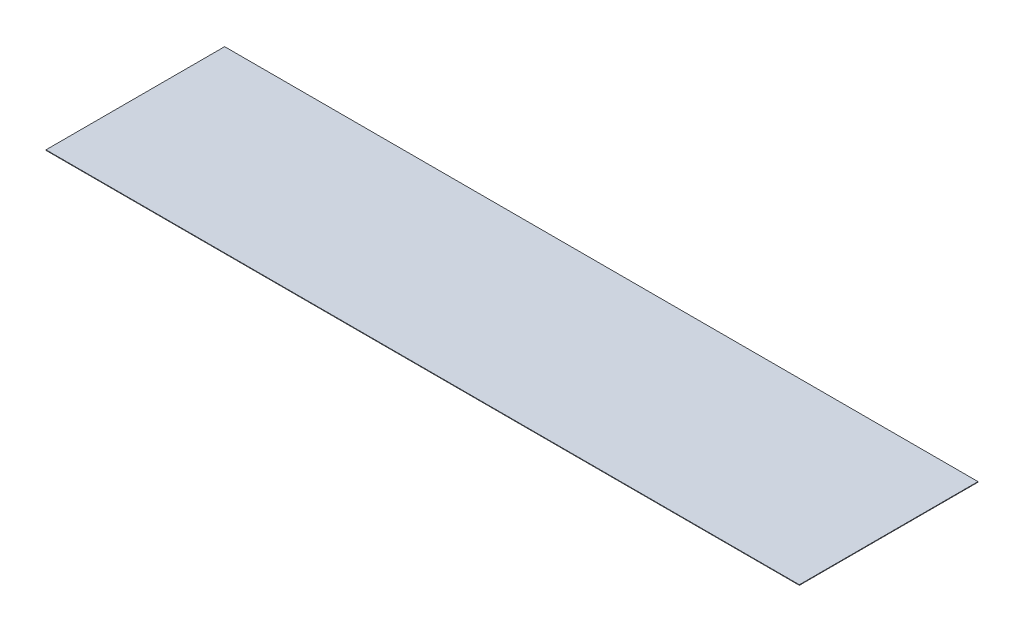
SolidWorks part; units mm, degrees
ref_plane "Front Plane" through (0, 0, 0) normal (0, 0, 1) x (1, 0, 0)
ref_plane "Top Plane" through (0, 0, 0) normal (0, 1, 0) x (1, 0, 0)
ref_plane "Right Plane" through (0, 0, 0) normal (1, 0, 0) x (0, 0, -1)
sketch "Sketch1" plane through (0, 0, 0) normal (0, 1, 0) x (1, 0, 0)
  line L1 (-2108.5, -500) -> (2108.5, -500)
  line L2 (-2108.5, -500) -> (-2108.5, 500)
  line L3 (-2108.5, 500) -> (2108.5, 500)
  line L4 (2108.5, -500) -> (2108.5, 500)
  line L5 (-2108.5, -500) -> (2108.5, 500) construction
  line L6 (-2108.5, 500) -> (2108.5, -500) construction
  point P1 (0, 0)
  dimension "D1" = 4217
  dimension "D2" = 1000
extrude "Boss-Extrude1" add sketch "Sketch1" along normal blind 3
